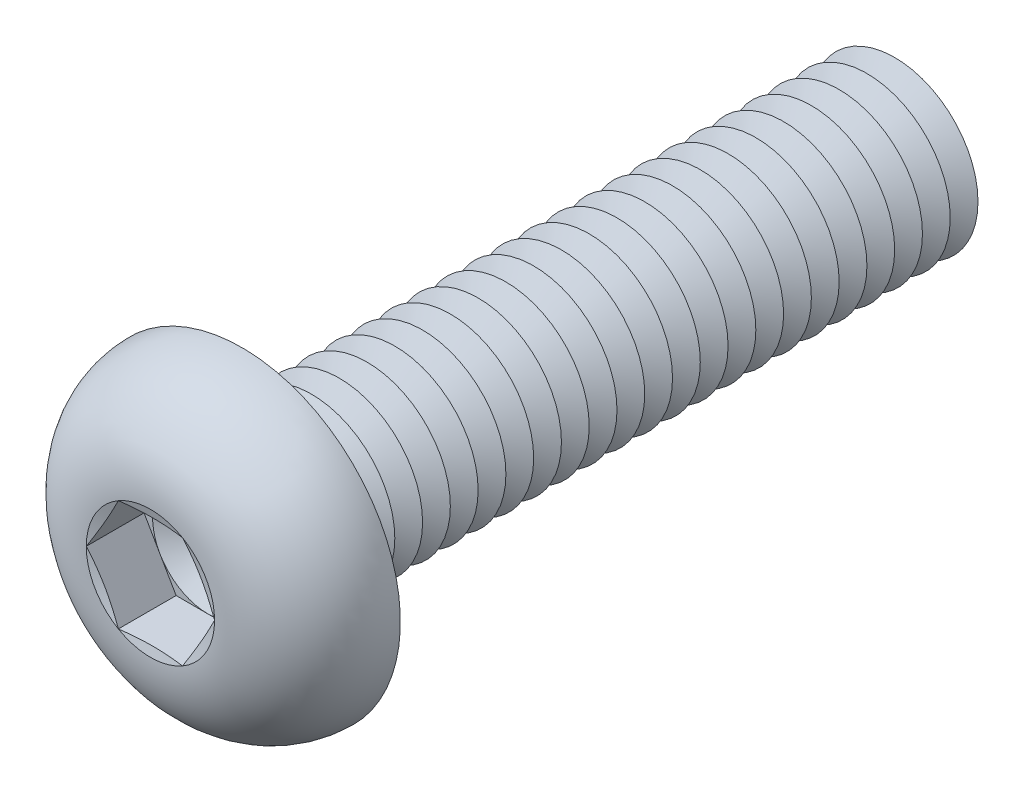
SolidWorks part; units mm, degrees
ref_plane "Front Plane" through (0, 0, 0) normal (0, 0, 1) x (1, 0, 0)
ref_plane "Top Plane" through (0, 0, 0) normal (0, 1, 0) x (1, 0, 0)
ref_plane "Right Plane" through (0, 0, 0) normal (1, 0, 0) x (0, 0, -1)
sketch "Sketch1" plane through (0, 0, 0) normal (1, 0, 0) x (0, 0, -1)
  line L0 (0, 1.5) -> (0, 2.85)
  line L3 (0, 1.5) -> (12, 1.5)
  line L4 (12, 1.5) -> (12, 0)
  line L5 (12, 0) -> (-1.65, 0) construction
  line L6 (-1.65, 0) -> (12, 0)
  line L7 (-1.65, 1.1547) -> (-1.65, 0.5773) construction
  line L8 (-1.65, 0.5773) -> (-1.65, 0)
  line L9 (-1.65, 1.1547) -> (-1.4953, 0.5773)
  line L10 (-1.4953, 0.5773) -> (-1.65, 0.5773)
  line L11 (12, 0) -> (22.7481, 0) construction
  line L12 (0, 2.85) -> (-1.65, 2.85) construction
  arc A1 (0, 2.85) -> (-1.65, 1.1547) centre (0, 1.1994) ccw
  point P8 (12, 0.75)
  dimension "D1" = 5.7
  dimension "D2" = 3
  dimension "D3" = 1.65
  dimension "D4" = 2.3094
  dimension "D5" = 12
  dimension "D6" = 15
revolve "Revolve1" add sketch "Sketch1" angle 360 about L5
fillet "Fillet1" radius 0.25 1 edges at (-1.5, 0, 0)
sketch "Sketch2" plane through (0, 0, 0) normal (1, 0, 0) x (0, 0, -1)
  line L0 (11.75, 1.5) -> (12.25, 1.5)
  line L1 (12, 1.5) -> (0.25, 1.5) construction
  line L2 (12.25, 1.5) -> (12, 1.067)
  line L3 (12, -1.5) -> (12, 1.5) construction
  line L4 (12, 1.067) -> (11.75, 1.5)
  dimension "D1" = 0.5
revolve "Cut-Revolve1" cut sketch "Sketch2" angle 360 about axis through (0, 0, -12) along (0, 0, -1)
pattern_linear "LPattern1" count 24 spacing 0.5 along (0, 0, 1) of "Cut-Revolve1"
sketch "Sketch3" plane through (0, 0, 1.65) normal (0, 0, 1) x (1, 0, 0)
  line L7 (0.5773, 1) -> (-0.5774, 1)
  line L8 (-0.5774, 1) -> (-1.1547, 0)
  line L9 (-1.1547, 0) -> (-0.5773, -1)
  line L10 (-0.5773, -1) -> (0.5773, -1)
  line L11 (0.5773, -1) -> (1.1547, 0)
  line L12 (1.1547, 0) -> (0.5773, 1)
  circle A0 centre (0, 0) radius 1 construction
  circle A3 centre (0, 0) radius 1.1547 construction
extrude "Cut-Extrude1" cut sketch "Sketch3" against normal blind 1.04
sketch "Sketch4" plane through (0, 0, 0.61) normal (0, 0, 1) x (1, 0, 0)
  line L1 (0.5773, 1) -> (-0.5774, 1) construction
  circle A0 centre (0, 0) radius 1
extrude "Cut-Extrude2" cut sketch "Sketch4" against normal through all draft 60
